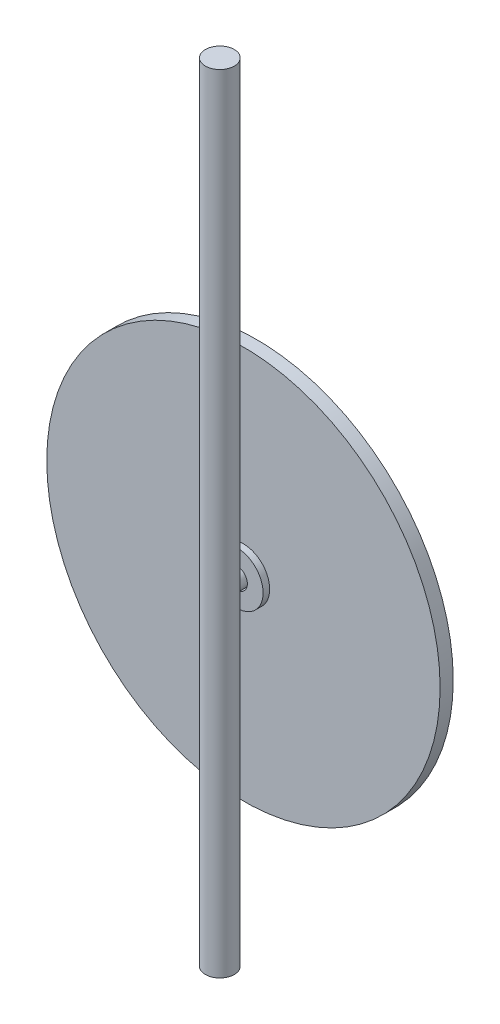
SolidWorks part; units mm, degrees
ref_plane "Alzado" through (0, 0, 0) normal (0, 0, 1) x (1, 0, 0)
ref_plane "Planta" through (0, 0, 0) normal (0, 1, 0) x (1, 0, 0)
ref_plane "Vista lateral" through (0, 0, 0) normal (1, 0, 0) x (0, 0, -1)
ref_plane "Plano1" through (0, 0, 638) normal (0, 0, -1) x (-1, 0, 0)
sketch "Croquis1" plane through (0, 0, 638) normal (0, 0, -1) x (-1, 0, 0)
  line L0 (-110.9873, -295.8993) -> (-99.9873, -295.8993)
  line L1 (-99.9873, -295.8993) -> (-99.9873, 304.1007)
  line L2 (-99.9873, 304.1007) -> (-110.9873, 304.1007)
  line L3 (-110.9873, 304.1007) -> (-110.9873, -295.8993)
  line L4 (-99.9873, -295.8993) -> (-99.9873, 304.1007) construction
revolve "Revolución1" add sketch "Croquis1" angle 360 about L4
ref_plane "Plano2" through (0, 284.1007, 0) normal (0, 1, 0) x (1, 0, 0)
sketch "Croquis2" plane through (0, 284.1007, 0) normal (0, 1, 0) x (1, 0, 0)
  line L0 (92.4375, -630) -> (107.5371, -630)
  arc A0 (107.5371, -630) -> (92.4375, -630) centre (99.9873, -638) ccw
extrude "Cortar-Extruir1" cut sketch "Croquis2" against normal blind 560
imported_body "Sólido importado3"
imported_body "Sólido importado5"
imported_body "Sólido importado6"
imported_body "Sólido importado7"
imported_body "Sólido importado8"
sketch "Croquis3" plane through (0, 0, 600) normal (0, 0, -1) x (-1, 0, 0)
  circle A0 centre (-99.9873, -45.8993) radius 59.944
  dimension "D1" = 119.888
extrude "Saliente-Extruir1" add sketch "Croquis3" along normal blind 39.878
